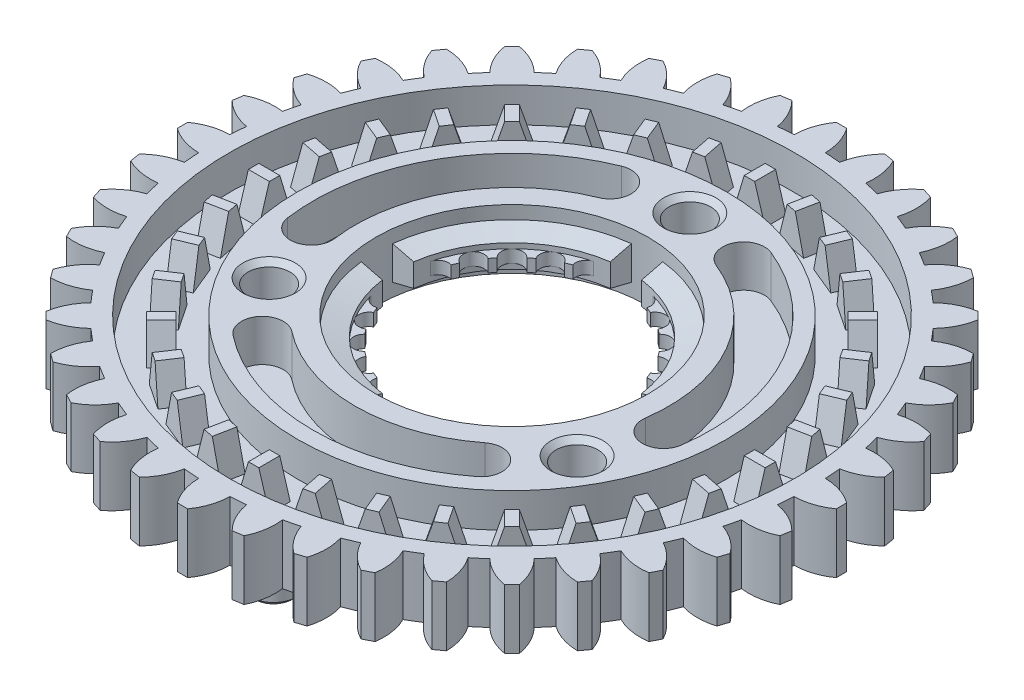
SolidWorks part; units mm, degrees
ref_plane "前视基准面" through (0, 0, 0) normal (0, 0, 1) x (1, 0, 0)
ref_plane "上视基准面" through (0, 0, 0) normal (0, 1, 0) x (1, 0, 0)
ref_plane "右视基准面" through (0, 0, 0) normal (1, 0, 0) x (0, 0, -1)
sketch "草图1" plane through (0, 0, 0) normal (0, 1, 0) x (1, 0, 0)
  circle A0 centre (0, 0) radius 28.5
  dimension "D1" = 57
extrude "凸台-拉伸1" add sketch "草图1" along normal blind 5.7
sketch "草图2" plane through (0, 0, 0) normal (0, 1, 0) x (1, 0, 0)
  line L0 (0, 0) -> (0, 28.5) construction
  line L1 (0, 28.5) -> (0, 31.5) construction
  line L2 (0.5, 31.5) -> (-0.5, 31.5)
  line L3 (0, 30) -> (-1.25, 30) construction
  line L4 (0, 28.5) -> (-1.5, 28.5) construction
  circle A0 centre (0, 0) radius 28.5 construction
  arc A1 (-0.5, 31.5) -> (-1.5008, 28.4605) centre (3.875, 28.375) ccw
  arc A2 (1.5008, 28.4605) -> (-1.5008, 28.4605) centre (0, 0) ccw
  arc A3 (0.5, 31.5) -> (1.5008, 28.4605) centre (-3.875, 28.375) cw
  dimension "D5" = 57
  dimension "D1" = 0.5
  dimension "D2" = 3
  dimension "D3" = 1.25
  dimension "D4" = 1.5
extrude "凸台-拉伸2" add sketch "草图2" along normal blind 5.7
pattern_circular "阵列(圆周)1" count 40 over 360 about axis through (0, 0, 0) along (0, 1, 0) of "凸台-拉伸2"
sketch "草图3" plane through (0, 5.7, 0) normal (0, 1, 0) x (1, 0, 0)
  circle A0 centre (0, 0) radius 27
  circle A1 centre (0, 0) radius 20.5
  dimension "D1" = 54
  dimension "D2" = 41
extrude "切除-拉伸1" cut sketch "草图3" against normal blind 3.3
sketch "草图4" plane through (0, 2.4, 0) normal (0, 1, 0) x (1, 0, 0)
  line L0 (0, 0) -> (0, 20.5) construction
  line L1 (0, 20.5) -> (0, 22.7) construction
  line L2 (0, 22.7) -> (0, 24.7) construction
  line L3 (1.5, 24.7) -> (-1.5, 24.7)
  line L4 (-1.5, 24.7) -> (-1.5, 22.7)
  line L5 (-1.5, 22.7) -> (1.5, 22.7)
  line L6 (1.5, 24.7) -> (1.5, 22.7)
  circle A0 centre (0, 0) radius 20.5 construction
  circle A1 centre (0, 0) radius 20.5 construction
  dimension "D1" = 2.2
  dimension "D2" = 2
  dimension "D3" = 1.5
sketch "草图5" plane through (0, 5.7, 0) normal (0, 1, 0) x (1, 0, 0)
  line L0 (0, 20.5) -> (0, 22.7) construction
  line L1 (0, 22.7) -> (0, 24.7) construction
  line L2 (0.5, 24.7) -> (-0.5, 24.7)
  line L3 (1.5, 24.7) -> (-1.5, 24.7) construction
  line L4 (-0.5, 24.7) -> (-0.5, 22.7)
  line L5 (-1.5, 22.7) -> (1.5, 22.7) construction
  line L6 (-0.5, 22.7) -> (0.5, 22.7)
  line L7 (0.5, 24.7) -> (0.5, 22.7)
  dimension "D1" = 0.5
loft "放样1" add profiles "草图5", "草图4"
pattern_circular "阵列(圆周)2" count 32 over 360 about axis through (0, 0, 0) along (0, 1, 0) of "放样1"
sketch "草图6" plane through (0, 5.7, 0) normal (0, 1, 0) x (1, 0, 0)
  circle A0 centre (0, 0) radius 13
  dimension "D1" = 26
extrude "切除-拉伸2" cut sketch "草图6" against normal blind 1.25
sketch "草图8" plane through (0, 0, 0) normal (0, -1, 0) x (1, 0, 0)
  circle A0 centre (0, 0) radius 13
  dimension "D1" = 26
extrude "切除-拉伸3" cut sketch "草图8" against normal blind 1.25
sketch "草图9" plane through (0, 0, 0) normal (1, 0, 0) x (0, 0, -1)
  line L0 (0, 0) -> (0, 1.25) construction
  line L1 (0, 1.25) -> (13, 1.25)
  line L2 (0, 0) -> (0, 2.85) construction
  line L3 (0, 1.25) -> (0, 1.75)
  line L4 (0, 1.75) -> (11, 1.75)
  line L5 (11, 1.75) -> (13, 1.25)
  line L6 (0, 2.85) -> (4.0673, 2.85) construction
  line L7 (11, 3.95) -> (13, 4.45)
  line L8 (0, 4.45) -> (13, 4.45)
  line L9 (0, 4.45) -> (0, 3.95)
  line L10 (0, 3.95) -> (11, 3.95)
  dimension "D1" = 1.25
  dimension "D2" = 2.85
  dimension "D3" = 0.5
  dimension "D4" = 13
  dimension "D5" = 11
revolve "切除-旋转1" cut sketch "草图9" angle 360 about L2
sketch "草图10" plane through (0, 3.95, 0) normal (0, 1, 0) x (1, 0, 0)
  circle A0 centre (0, 0) radius 11
  dimension "D1" = 22
extrude "切除-拉伸4" cut sketch "草图10" against normal blind 0.5
sketch "草图11" plane through (0, 1.75, 0) normal (0, -1, 0) x (1, 0, 0)
  circle A0 centre (0, 0) radius 11
  dimension "D1" = 22
extrude "切除-拉伸5" cut sketch "草图11" against normal blind 0.5
sketch "草图12" plane through (0, 3.45, 0) normal (0, 1, 0) x (1, 0, 0)
  line L0 (0, 0) -> (0, 10) construction
  arc A0 (-3.54, 9.3525) -> (-4.1101, 9.1163) centre (0, 0) ccw
  arc A1 (0.9987, 9.95) -> (-0.9987, 9.95) centre (0, 10) ccw construction
  arc A2 (3.54, 9.3525) -> (2.847, 10.6252) centre (2.5882, 9.6593) ccw
  arc A3 (5.8399, 8.1176) -> (4.1101, 9.1163) centre (5, 8.6603) ccw
  arc A4 (7.7419, 6.3295) -> (6.3295, 7.7419) centre (7.0711, 7.0711) ccw
  arc A5 (9.1163, 4.1101) -> (8.1176, 5.8399) centre (8.6603, 5) ccw
  arc A6 (10.6252, 2.847) -> (9.3525, 3.54) centre (9.6593, 2.5882) ccw
  arc A7 (4.1101, 9.1163) -> (3.54, 9.3525) centre (0, 0) ccw
  arc A8 (9.3525, -3.54) -> (10.6252, -2.847) centre (9.6593, -2.5882) ccw
  arc A9 (8.1176, -5.8399) -> (9.1163, -4.1101) centre (8.6603, -5) ccw
  arc A10 (6.3295, -7.7419) -> (7.7419, -6.3295) centre (7.0711, -7.0711) ccw
  arc A11 (4.1101, -9.1163) -> (5.8399, -8.1176) centre (5, -8.6603) ccw
  arc A12 (2.847, -10.6252) -> (3.54, -9.3525) centre (2.5882, -9.6593) ccw
  arc A13 (5.8399, -8.1176) -> (6.3295, -7.7419) centre (0, 0) ccw
  arc A14 (-3.54, -9.3525) -> (-2.847, -10.6252) centre (-2.5882, -9.6593) ccw
  arc A15 (-5.8399, -8.1176) -> (-4.1101, -9.1163) centre (-5, -8.6603) ccw
  arc A16 (-7.7419, -6.3295) -> (-6.3295, -7.7419) centre (-7.0711, -7.0711) ccw
  arc A17 (-9.1163, -4.1101) -> (-8.1176, -5.8399) centre (-8.6603, -5) ccw
  arc A18 (-10.6252, -2.847) -> (-9.3525, -3.54) centre (-9.6593, -2.5882) ccw
  arc A19 (-2.847, -10.6252) -> (2.847, -10.6252) centre (0, 0) ccw
  arc A20 (-9.3525, 3.54) -> (-10.6252, 2.847) centre (-9.6593, 2.5882) ccw
  arc A21 (-8.1176, 5.8399) -> (-9.1163, 4.1101) centre (-8.6603, 5) ccw
  arc A22 (-6.3295, 7.7419) -> (-7.7419, 6.3295) centre (-7.0711, 7.0711) ccw
  arc A23 (-4.1101, 9.1163) -> (-5.8399, 8.1176) centre (-5, 8.6603) ccw
  arc A24 (-2.847, 10.6252) -> (-3.54, 9.3525) centre (-2.5882, 9.6593) ccw
  arc A25 (-10.6252, 2.847) -> (-10.6252, -2.847) centre (0, 0) ccw
  arc A26 (-5.8399, 8.1176) -> (-6.3295, 7.7419) centre (0, 0) ccw
  arc A27 (-7.7419, 6.3295) -> (-8.1176, 5.8399) centre (0, 0) ccw
  arc A28 (-9.1163, 4.1101) -> (-9.3525, 3.54) centre (0, 0) ccw
  arc A29 (-9.3525, -3.54) -> (-9.1163, -4.1101) centre (0, 0) ccw
  arc A30 (-11, 0) -> (-9.95, -0.9987) centre (-10, 0) ccw
  arc A31 (-8.1176, -5.8399) -> (-7.7419, -6.3295) centre (0, 0) ccw
  arc A32 (-6.3295, -7.7419) -> (-5.8399, -8.1176) centre (0, 0) ccw
  arc A33 (-4.1101, -9.1163) -> (-3.54, -9.3525) centre (0, 0) ccw
  arc A34 (3.54, -9.3525) -> (4.1101, -9.1163) centre (0, 0) ccw
  arc A35 (0, -11) -> (0.9987, -9.95) centre (0, -10) ccw
  arc A36 (7.7419, -6.3295) -> (8.1176, -5.8399) centre (0, 0) ccw
  arc A37 (9.1163, -4.1101) -> (9.3525, -3.54) centre (0, 0) ccw
  arc A38 (10.6252, -2.847) -> (10.6252, 2.847) centre (0, 0) ccw
  arc A39 (9.3525, 3.54) -> (9.1163, 4.1101) centre (0, 0) ccw
  arc A40 (11, 0) -> (9.95, 0.9987) centre (10, 0) ccw
  arc A41 (6.3295, 7.7419) -> (5.8399, 8.1176) centre (0, 0) ccw
  arc A42 (8.1176, 5.8399) -> (7.7419, 6.3295) centre (0, 0) ccw
  arc A43 (2.847, 10.6252) -> (-2.847, 10.6252) centre (0, 0) ccw
  point P78 (0, 0)
  dimension "D1" = 20
  dimension "D2" = 1
  dimension "D4" = 22
  dimension "D3" = 24
extrude "切除-拉伸6" cut sketch "草图12" against normal through all
sketch "草图14" plane through (0, 5.7, 0) normal (0, 1, 0) x (1, 0, 0)
  line L1 (1.5, 10.8972) -> (1.5, 12.9132)
  line L3 (-1.5, 10.8972) -> (-1.5, 12.9132)
  arc A0 (1.5, 12.9132) -> (-1.5, 12.9132) centre (0, 0) ccw
  arc A1 (1.5, 10.8972) -> (-1.5, 10.8972) centre (0, 0) ccw
  dimension "D1" = 26
  dimension "D2" = 22
extrude "切除-拉伸7" cut sketch "草图14" against normal through all
pattern_circular "阵列(圆周)3" count 4 over 360 about axis through (0, 0, 0) along (0, 1, 0) of "切除-拉伸7"
sketch "草图15" plane through (0, 5.7, 0) normal (0, 1, 0) x (1, 0, 0)
  line L0 (0, 0) -> (0, 13) construction
  line L1 (0, 13) -> (0, 15) construction
  line L2 (0, 15) -> (0, 17) construction
  circle A0 centre (0, 0) radius 13 construction
  circle A1 centre (0, 17) radius 2
  dimension "D1" = 2
  dimension "D2" = 2
extrude "切除-拉伸8" cut sketch "草图15" against normal through all
chamfer "倒角1" distance 0.5 angle 45 2 edges at (0, 0, -15) (0, 5.7, -15)
pattern_circular "阵列(圆周)4" count 3 over 360 about axis through (0, 0, 0) along (0, 1, 0) of "切除-拉伸8", "倒角1"
sketch "草图16" plane through (0, 5.7, 0) normal (0, 1, 0) x (1, 0, 0)
  line L0 (0, 0) -> (0, 17) construction
  line L1 (0, 0) -> (-6.3801, 15.7574) construction
  line L2 (0, 0) -> (-14.7224, -8.5) construction
  line L3 (0, 0) -> (-16.8363, -2.3533) construction
  arc A0 (-5.6295, 13.9035) -> (-14.8556, -2.0765) centre (0, 0) ccw
  arc A1 (-7.1307, 17.6112) -> (-18.8171, -2.6302) centre (0, 0) ccw
  circle A2 centre (0, 0) radius 17 construction
  arc A3 (-5.6295, 13.9035) -> (-7.1307, 17.6112) centre (-6.3801, 15.7574) ccw
  arc A4 (-18.8171, -2.6302) -> (-14.8556, -2.0765) centre (-16.8363, -2.3533) ccw
  dimension "D2" = 38
  dimension "D3" = 34
  dimension "D4" = 6.5
  dimension "D5" = 6.5
extrude "切除-拉伸9" cut sketch "草图16" against normal blind 4
pattern_circular "阵列(圆周)5" count 3 over 360 about axis through (0, 0, 0) along (0, 1, 0) of "切除-拉伸9"
sketch "草图17" plane through (0, 0, 0) normal (0, -1, 0) x (1, 0, 0)
  line L0 (0, 0) -> (0, -17) construction
  line L1 (0, 0) -> (19.7454, -11.4) construction
  circle A0 centre (0, 0) radius 22.8 construction
  circle A1 centre (19.7454, -11.4) radius 2.2
  dimension "D1" = 45.6
  dimension "D3" = 4.4
  dimension "D2" = 60
extrude "凸台-拉伸3" add sketch "草图17" along normal blind 5.5
chamfer "倒角2" distance 0.4 angle 45 1 edges at (19.7454, -5.5, -13.6)
pattern_circular "阵列(圆周)6" count 3 over 360 about axis through (0, 0, 0) along (0, 1, 0) of "凸台-拉伸3", "倒角2"
